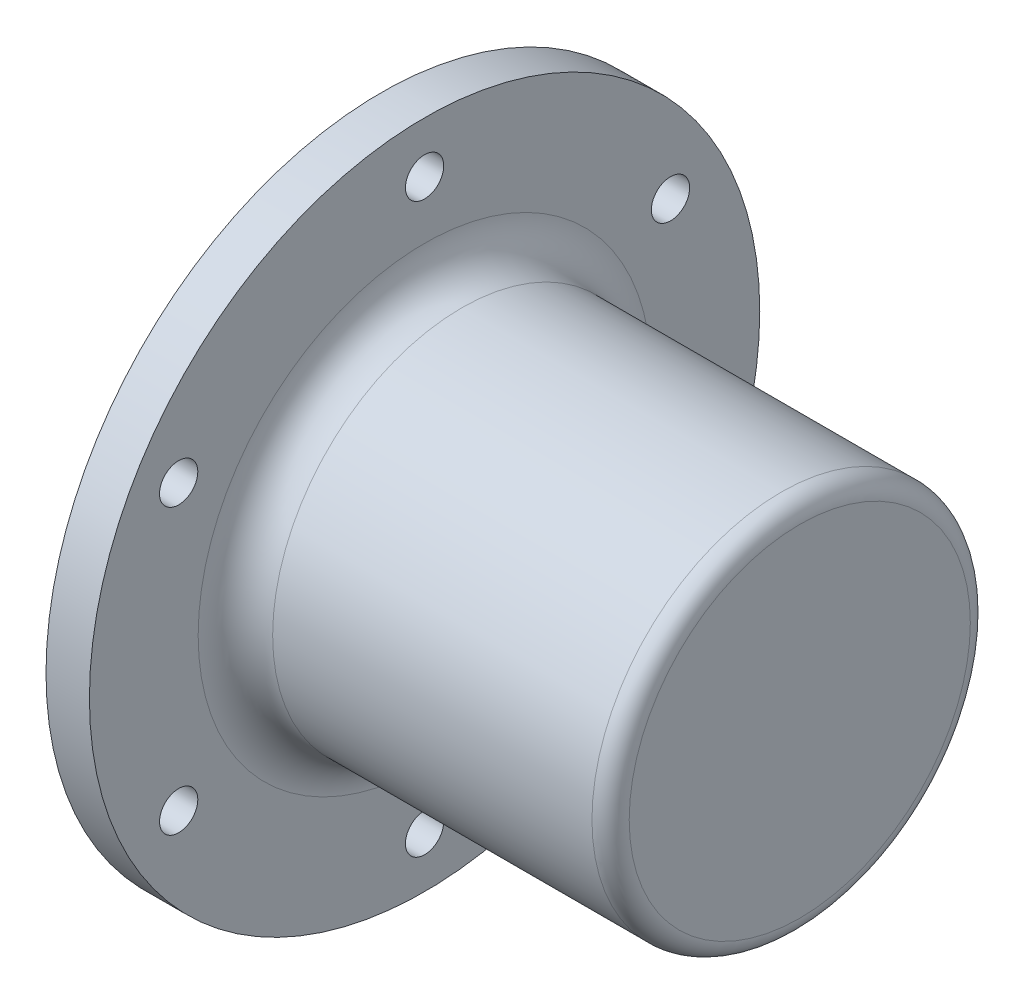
SolidWorks part; units mm, degrees
ref_plane "Front Plane" through (0, 0, 0) normal (0, 0, 1) x (1, 0, 0)
ref_plane "Top Plane" through (0, 0, 0) normal (0, 1, 0) x (1, 0, 0)
ref_plane "Right Plane" through (0, 0, 0) normal (1, 0, 0) x (0, 0, -1)
sketch "Sketch1" plane through (0, 0, 0) normal (0, 0, 1) x (1, 0, 0)
  line L0 (26.255, 28.575) -> (26.255, 16.129)
  line L1 (26.255, 16.129) -> (58.2411, 16.129)
  line L2 (58.2411, 16.129) -> (58.2411, 0)
  line L3 (58.2411, 0) -> (55.4471, 0)
  line L4 (55.4471, 0) -> (55.4471, 15.24)
  line L5 (55.4471, 15.24) -> (22.5541, 15.24)
  line L6 (22.5541, -28.575) -> (26.255, -28.575) construction
  line L7 (26.255, -16.129) -> (58.2411, -16.129) construction
  line L8 (22.5541, 15.24) -> (22.5541, 28.575)
  line L9 (22.5541, 28.575) -> (26.255, 28.575)
  line L10 (0, 0) -> (38.9428, 0) construction
  line L11 (26.255, -15.24) -> (22.5541, -15.24) construction
  line L14 (29.0779, -14.859) -> (54.6851, -14.859) construction
  dimension "D1" = 57.15
  dimension "D2" = 32.258
  dimension "D3" = 30.48
  dimension "D4" = 35.687
  dimension "D5" = 32.893
  dimension "D6" = 3.7009
  dimension "D7" = 2.794
  dimension "D8" = 29.1921
  dimension "D9" = 0.889
  dimension "D10" = 2.794
  dimension "D11" = 22.5541
revolve "Revolve1" add sketch "Sketch1" angle 360 about L10
ref_plane "Plane1" through (22.5541, 0, 0) normal (0, -1, 0) x (0, 0, 1)
sketch "Sketch4" plane through (22.5541, 0, 0) normal (0, 0, 1) x (0, 1, 0)
  line L0 (15.715, -1.0381) -> (15.6242, 0)
  line L1 (15.6242, 0) -> (18.1578, 0)
  line L2 (18.1578, 0) -> (18.067, -1.0381)
  line L3 (17.814, -1.27) -> (15.968, -1.27)
  line L4 (0, 50) -> (0, -50) construction
  line L5 (15.24, 0) -> (-15.24, 0) construction
  line L6 (15.7353, -1.27) -> (15.7353, 1.6724) construction
  line L7 (-15.7353, -1.27) -> (-15.7353, 1.6724) construction
  arc A0 (18.067, -1.0381) -> (17.814, -1.27) centre (17.814, -1.016) cw
  arc A1 (15.968, -1.27) -> (15.715, -1.0381) centre (15.968, -1.016) cw
  point P11 (18.0467, -1.27)
  point P12 (15.7353, -1.27)
  dimension "D3" = 0.254
  dimension "D4" = 0.254
  dimension "D1" = 95
  dimension "D2" = 95
  dimension "D5" = 2.3114
  dimension "D6" = 1.27
  dimension "D7" = 31.4706
revolve "Groove for AS 568-026, O-Ring1" cut sketch "Sketch4"
ref_plane "Plane2" through (22.5541, 0, 0) normal (0, -1, 0) x (0, 0, 1)
sketch "Sketch5" plane through (22.5541, 0, 0) normal (0, 0, 1) x (0, 1, 0)
  line L0 (18.89, -1.0381) -> (18.7992, 0)
  line L1 (18.7992, 0) -> (21.5868, 0)
  line L2 (21.5868, 0) -> (21.496, -1.0381)
  line L3 (21.243, -1.27) -> (19.143, -1.27)
  line L4 (0, 50) -> (0, -50) construction
  line L5 (18.9103, -1.27) -> (18.9103, 2.4869) construction
  line L6 (-18.9103, -1.27) -> (-18.9103, 2.4869) construction
  arc A0 (21.496, -1.0381) -> (21.243, -1.27) centre (21.243, -1.016) cw
  arc A1 (19.143, -1.27) -> (18.89, -1.0381) centre (19.143, -1.016) cw
  point P11 (21.4757, -1.27)
  point P12 (18.9103, -1.27)
  dimension "D3" = 0.254
  dimension "D4" = 0.254
  dimension "D1" = 95
  dimension "D2" = 95
  dimension "D5" = 1.27
  dimension "D6" = 2.5654
  dimension "D7" = 37.8206
revolve "Groove for AS 568-029, O-Ring1" cut sketch "Sketch5" angle 360 about L4
hole_wizard "#4 Clearance Hole1" positions "Sketch3" profile "Sketch2" hole size "#4" standard "Ansi Inch"
sketch "Sketch3" plane through (26.255, 0, 0) normal (1, 0, 0) x (0, 0, -1)
  circle A0 centre (0, 24.2094) radius 2.3241 construction
  circle A2 centre (0, 0) radius 24.2094 construction
  point P0 (0, 24.2094)
  dimension "D1" = 4.6482
  dimension "D2" = 48.4188
sketch "Sketch2" plane through (26.255, 24.2094, 0) normal (0, 1, 0) x (0, 0, -1)
  line L0 (0, 0) -> (0, 3.7009)
  line L1 (0, 3.7009) -> (1.6319, 3.7009)
  line L2 (1.6319, 3.7009) -> (1.6319, 0)
  line L5 (1.6319, 0) -> (0, 0)
  line L11 (0, -6.35) -> (0, 107.95) construction
  dimension "Thru Hole Dia." = 3.2639
  dimension "Thru Hole Depth" = 3.7009
pattern_circular "CirPattern1" count 6 over 360 about axis through (0, 0, 0) along (1, 0, 0) of "#4 Clearance Hole1"
fillet "Fillet1" radius 3.175 1 edges at (26.255, 0, 16.129)
fillet "Fillet2" radius 1.5875 2 edges at (58.2411, 0, 16.129) (55.4471, 0, 15.24)
sketch3d "CenterOfMass 10/16/2008 14:19:46"
  point P0 (37.8421, 0, 0)
sketch "Sketch6" plane through (0, 0, 0) normal (0, 0, 1) x (1, 0, 0)
  line L0 (53.8596, 15.24) -> (22.5541, 15.24) construction
  line L1 (53.8596, 15.24) -> (22.5541, 15.24)
  line L2 (55.4471, 13.6525) -> (55.4471, -13.6525) construction
  line L3 (55.4471, 13.6525) -> (55.4471, 0)
  line L4 (0, 0) -> (-4.8409, 0) construction
  line L5 (14.6752, 0) -> (41.7742, 0) construction
  line L6 (22.5541, 0) -> (55.4471, 0)
  line L7 (22.5541, 15.24) -> (22.5541, 0)
  line L8 (22.5541, 28.575) -> (22.5541, -28.575) construction
  arc A0 (55.4471, 13.6525) -> (53.8596, 15.24) centre (53.8596, 13.6525) ccw construction
  arc A1 (55.4471, 13.6525) -> (53.8596, 15.24) centre (53.8596, 13.6525) ccw
revolve "VolumeCalc" [suppressed] add sketch "Sketch6" angle 360 about L4
